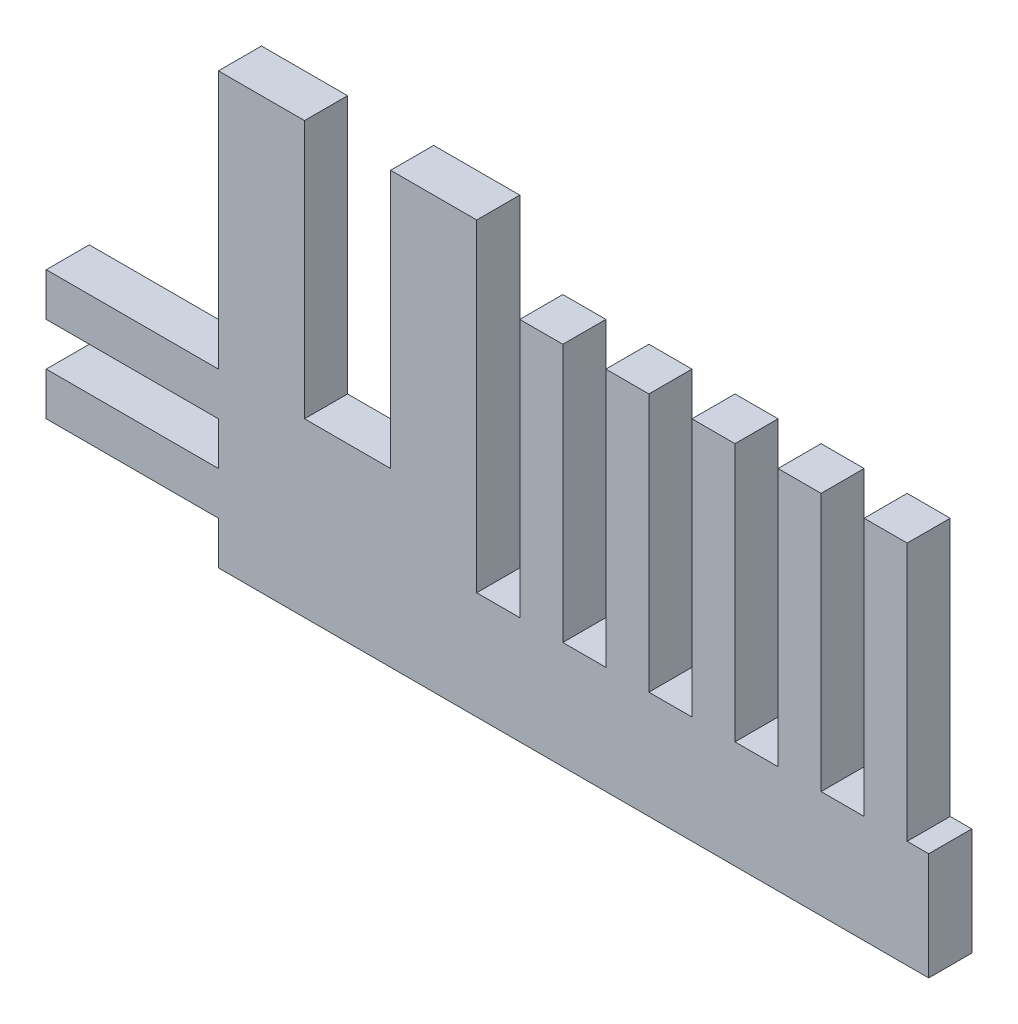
SolidWorks part; units mm, degrees
ref_plane "Front Plane" through (0, 0, 0) normal (0, 0, 1) x (1, 0, 0)
ref_plane "Top Plane" through (0, 0, 0) normal (0, 1, 0) x (1, 0, 0)
ref_plane "Right Plane" through (0, 0, 0) normal (1, 0, 0) x (0, 0, -1)
sketch "Sketch1" plane through (0, 0, 0) normal (0, 0, 1) x (1, 0, 0)
  line L0 (0, 0) -> (0, 1)
  line L1 (0, 1) -> (-4, 1)
  line L2 (-4, 1) -> (-4, 2)
  line L3 (-4, 2) -> (0, 2)
  line L4 (0, 2) -> (0, 3)
  line L5 (0, 3) -> (-4, 3)
  line L6 (-4, 3) -> (-4, 4)
  line L7 (-4, 4) -> (0, 4)
  line L8 (0, 4) -> (0, 10)
  line L9 (0, 10) -> (2, 10)
  line L10 (2, 10) -> (2, 4)
  line L11 (2, 4) -> (4, 4)
  line L12 (4, 4) -> (4, 10)
  line L13 (4, 10) -> (6, 10)
  line L14 (6, 10) -> (6, 2.5)
  line L15 (6, 2.5) -> (6.5, 2.5)
  line L16 (7, 2.5) -> (7, 8.5)
  line L17 (7, 8.5) -> (8, 8.5)
  line L18 (8, 8.5) -> (8, 2.5)
  line L19 (6.5, 2.5) -> (7, 2.5)
  line L20 (16.5, 0) -> (16.5, 2.5)
  line L21 (16.5, 0) -> (0, 0)
  line L22 (8.5, 2.5) -> (9, 2.5)
  line L23 (9, 2.5) -> (9, 8.5)
  line L24 (9, 8.5) -> (10, 8.5)
  line L25 (10, 8.5) -> (10, 2.5)
  line L26 (10, 2.5) -> (10.5, 2.5)
  line L27 (10.5, 2.5) -> (11, 2.5)
  line L28 (11, 2.5) -> (11, 8.5)
  line L29 (11, 8.5) -> (12, 8.5)
  line L30 (12, 8.5) -> (12, 2.5)
  line L31 (12, 2.5) -> (12.5, 2.5)
  line L32 (12.5, 2.5) -> (13, 2.5)
  line L33 (13, 2.5) -> (13, 8.5)
  line L34 (8, 2.5) -> (8.5, 2.5)
  line L35 (13, 8.5) -> (14, 8.5)
  line L36 (14, 8.5) -> (14, 2.5)
  line L37 (14, 2.5) -> (14.5, 2.5)
  line L38 (14.5, 2.5) -> (15, 2.5)
  line L39 (15, 2.5) -> (15, 8.5)
  line L40 (15, 8.5) -> (16, 8.5)
  line L41 (16, 8.5) -> (16, 2.5)
  line L42 (16, 2.5) -> (16.5, 2.5)
  dimension "D1" = 1
  dimension "D2" = 6
  dimension "D3" = 16.5
  dimension "D4" = 2
  dimension "D5" = 2.5
  dimension "D7" = 6
  dimension "D8" = 4
  dimension "D9" = 1
  dimension "D12" = 0.5
extrude "Extrude1" add sketch "Sketch1" along normal blind 1
